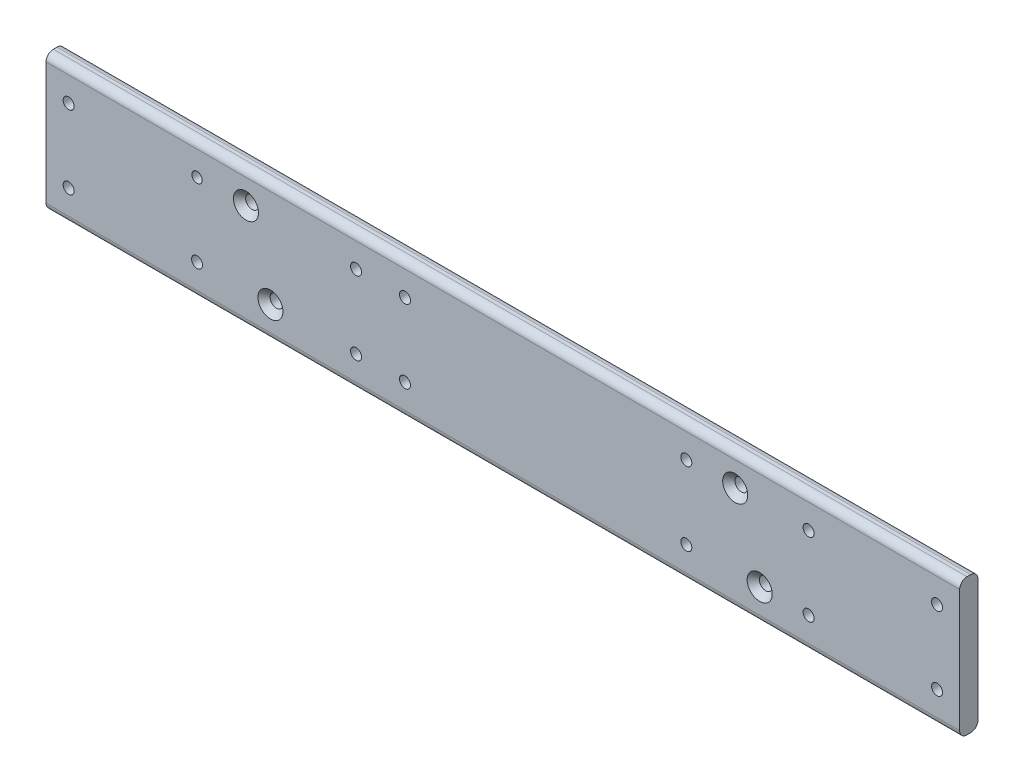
SolidWorks part; units mm, degrees
ref_plane "Plan1" through (0, 0, 0) normal (0, 0, 1) x (1, 0, 0)
ref_plane "Plan2" through (0, 0, 0) normal (0, 1, 0) x (1, 0, 0)
ref_plane "Plan3" through (0, 0, 0) normal (1, 0, 0) x (0, 0, -1)
sketch "Esquisse1" plane through (0, 0, 0) normal (0, 0, 1) x (1, 0, 0)
  line L0 (752, 112) -> (1499, 112)
  line L1 (752, 112) -> (752, 0)
  line L2 (1499, 0) -> (752, 0)
  line L3 (1499, 0) -> (1499, 112)
  circle A0 centre (875.5, 86) radius 4.25
  circle A1 centre (1045.5, 86) radius 4.5
  circle A2 centre (1005.5, 86) radius 4.5
  circle A3 centre (1275.5, 86) radius 4.5
  circle A4 centre (770.5, 86) radius 4.5
  circle A5 centre (770.5, 26) radius 4.5
  circle A6 centre (1480.5, 86) radius 4.5
  circle A7 centre (1480.5, 26) radius 4.5
  circle A8 centre (1005.5, 26) radius 4.5
  circle A9 centre (1275.5, 26) radius 4.5
  circle A10 centre (1375.5, 86) radius 4.5
  circle A11 centre (1375.5, 26) radius 4.5
  circle A12 centre (1045.5, 26) radius 4.5
  circle A13 centre (915.5, 86) radius 5.25
  circle A14 centre (875.5, 26) radius 4.5
  circle A17 centre (935.5, 26) radius 5.25
  circle A18 centre (1315.5, 86) radius 5.25
  circle A19 centre (1335.5, 26) radius 5.25
  point P10 (752, 0)
  point P13 (1499, 112)
  point P16 (1499, 0)
  dimension "D3" = 105
  dimension "D4" = 60
  dimension "D7" = 9
  dimension "D15" = 105
  dimension "D16" = 10.5
  dimension "D1" = 112
  dimension "D2" = 747
  dimension "D5" = 26
  dimension "D6" = 18.5
  dimension "D8" = 60
  dimension "D10" = 18.5
  dimension "D11" = 40
  dimension "D12" = 400
  dimension "D13" = 100
  dimension "D14" = 270
  dimension "D18" = 20
  dimension "D19" = 20
  dimension "D20" = 40
  dimension "D21" = 40
  dimension "D22" = 70
extrude "Base-Extrusion" add sketch "Esquisse1" along normal blind 15
fillet "Congé1" radius 6
chamfer "Chanfrein1" distance 5 angle 45
sketch "Esquisse2" plane through (0, 0, 0) normal (0, 0, -1) x (-1, 0, 0)
  point P0 (-935.5, 26)
  point P1 (-1335.5, 26)
